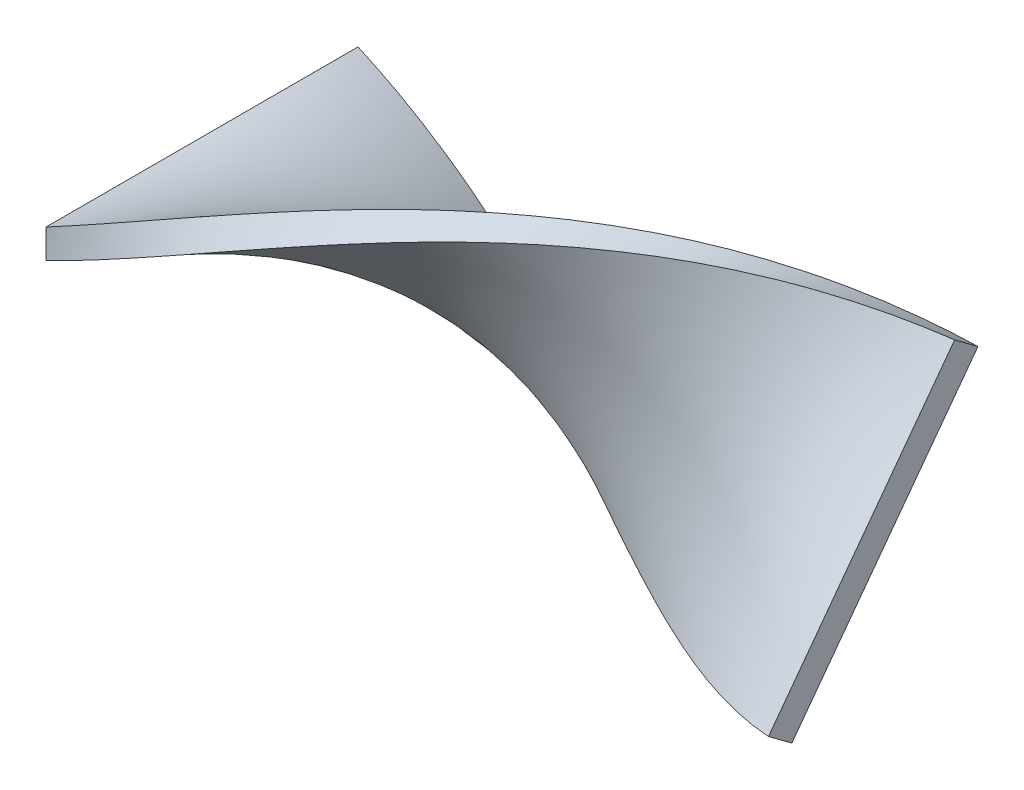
SolidWorks part; units mm, degrees
ref_plane "Front Plane" through (0, 0, 0) normal (0, 0, 1) x (1, 0, 0)
ref_plane "Top Plane" through (0, 0, 0) normal (0, 1, 0) x (1, 0, 0)
ref_plane "Right Plane" through (0, 0, 0) normal (1, 0, 0) x (0, 0, -1)
sketch "Sketch1" plane through (0, 0, 0) normal (0, 1, 0) x (1, 0, 0)
  line L0 (34.564, -16.0727) -> (-34.564, 16.0727) construction
  line L1 (-34.564, 16.0727) -> (34.564, 16.0727)
  line L2 (-34.564, 16.0727) -> (-34.564, -16.0727)
  line L3 (-34.564, -16.0727) -> (34.564, -16.0727)
  line L4 (34.564, 16.0727) -> (34.564, -16.0727)
extrude "Extrude1" add sketch "Sketch1" along normal blind 3
other "Flex" parameters "D0"=126.624, "D1"=0, "D2"=0
